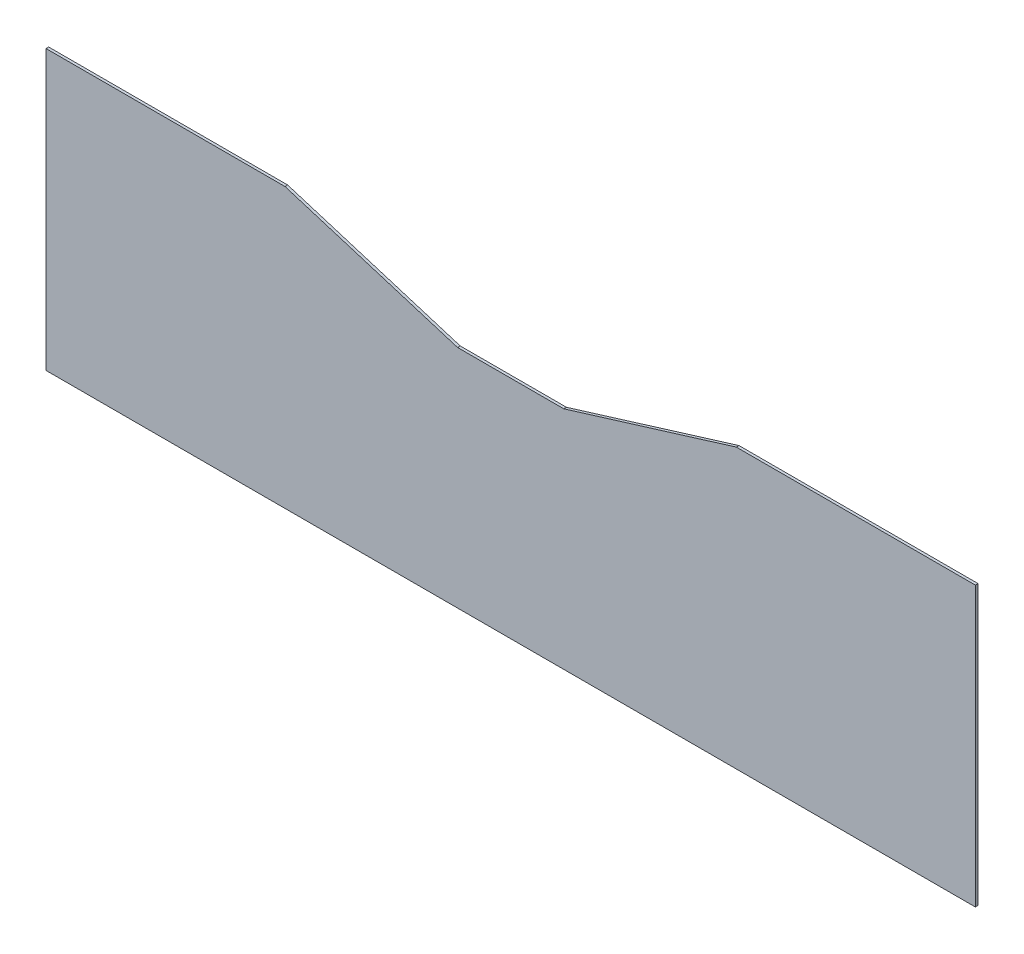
SolidWorks part; units mm, degrees
ref_plane "Plan de face" through (0, 0, 0) normal (0, 0, 1) x (1, 0, 0)
ref_plane "Plan de dessus" through (0, 0, 0) normal (0, 1, 0) x (1, 0, 0)
ref_plane "Plan de droite" through (0, 0, 0) normal (1, 0, 0) x (0, 0, -1)
sketch "Esquisse1" plane through (0, 0, 0) normal (0, 0, 1) x (1, 0, 0)
  line L0 (0, 0) -> (700, 0)
  line L1 (700, 0) -> (700, 210)
  line L2 (700, 210) -> (520, 210)
  line L3 (520, 210) -> (390, 170)
  line L4 (390, 170) -> (310, 170)
  line L5 (310, 170) -> (180, 210)
  line L6 (180, 210) -> (0, 210)
  line L7 (0, 210) -> (0, 0)
  line L8 (350, 170) -> (350, 0) construction
  dimension "D1" = 700
  dimension "D2" = 80
  dimension "D3" = 210
  dimension "D4" = 210
  dimension "D5" = 40
  dimension "D6" = 180
  dimension "D7" = 180
sheet metal parameters "Tôlerie 1" thickness 2 parameters "D1"=0.7366
base flange "Tôle de base pliée1" sketch "Esquisse1" thickness 2 reverse thickness direction yes parameters "D1"=0.7366
flat pattern "Etat déplié1"
sketch "Lignes de pliage1" plane through (0, 0, 0) normal (0, 1, 0) x (-1, 0, 0)
